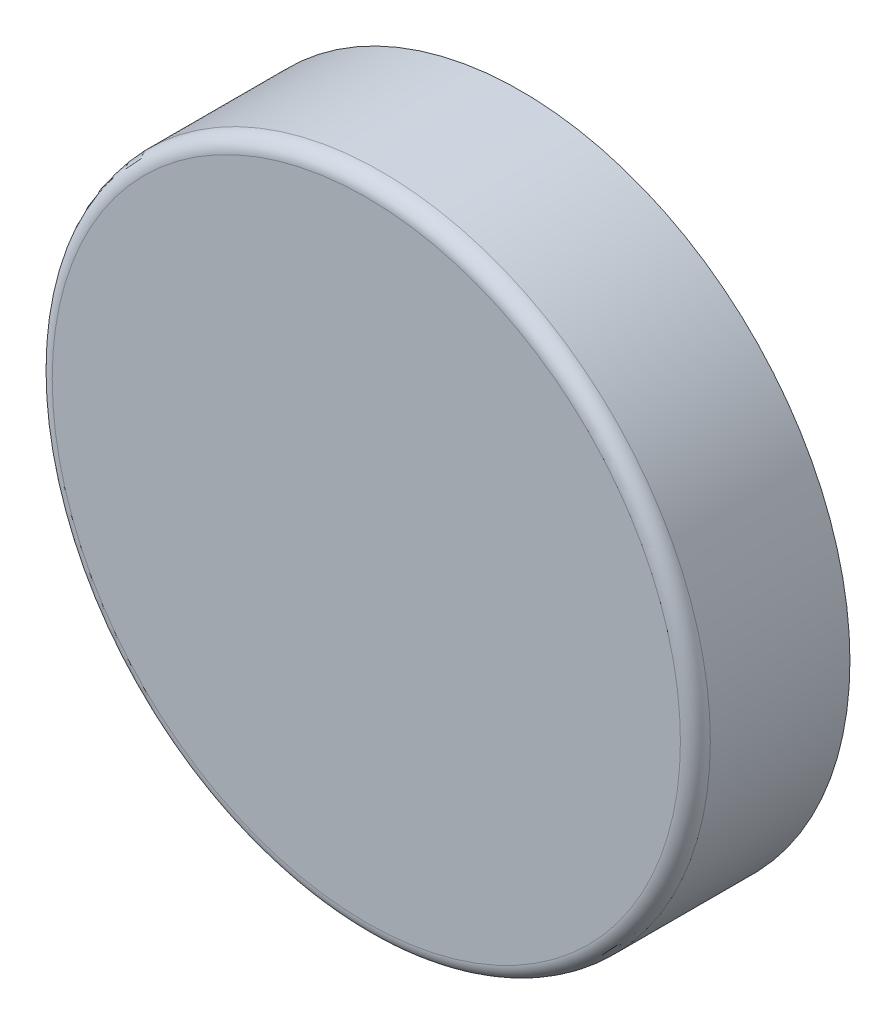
SolidWorks part; units mm, degrees
ref_plane "Plan de face" through (0, 0, 0) normal (0, 0, 1) x (1, 0, 0)
ref_plane "Plan de dessus" through (0, 0, 0) normal (0, 1, 0) x (1, 0, 0)
ref_plane "Plan de droite" through (0, 0, 0) normal (1, 0, 0) x (0, 0, -1)
sketch "Esquisse1" plane through (0, 0, 0) normal (0, 0, 1) x (1, 0, 0)
  circle A0 centre (0, 0) radius 6.6
extrude "Boss.-Extru.1" add sketch "Esquisse1" along normal blind 3.1
sketch "Esquisse2" plane through (0, 0, 0) normal (0, 0, -1) x (-1, 0, 0)
  circle A0 centre (0, 0) radius 5.95
extrude "Enlèv. mat.-Extru.1" cut sketch "Esquisse2" against normal blind 2.04
fillet "Congé1" radius 0.3 1 edges at (6.6, 0, 3.1)
